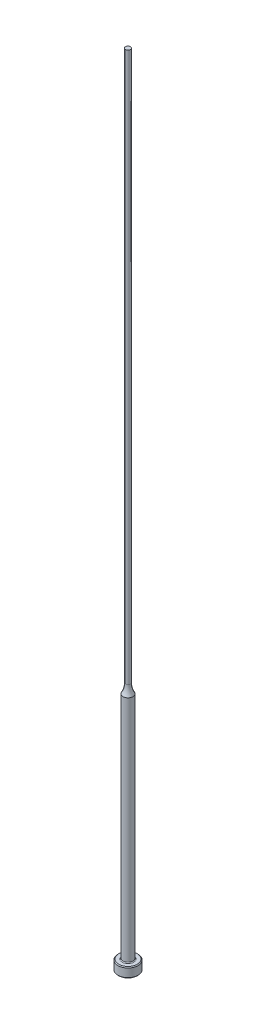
SolidWorks part; units mm, degrees
ref_plane "Front Plane" through (0, 0, 0) normal (0, 0, 1) x (1, 0, 0)
ref_plane "Top Plane" through (0, 0, 0) normal (0, 1, 0) x (1, 0, 0)
ref_plane "Right Plane" through (0, 0, 0) normal (1, 0, 0) x (0, 0, -1)
sketch "Sketch1" plane through (0, 0, 0) normal (0, 0, 1) x (1, 0, 0)
  line L0 (0, 259.9588) -> (0, -15.1925) construction
  line L1 (0, 0) -> (-3.175, 0)
  line L2 (-3.175, 0) -> (-3.175, 3.175)
  line L3 (-3.175, 3.175) -> (-1.5875, 3.175)
  line L4 (-0.7937, 79.2742) -> (-0.7937, 254)
  line L5 (-0.7937, 254) -> (0, 254)
  line L6 (0, 254) -> (0, 0)
  line L7 (-1.5875, 3.175) -> (-1.5875, 76.2)
  arc A0 (-1.5875, 76.2) -> (-0.7937, 79.2742) centre (-7.1437, 79.2742) ccw
  point P13 (-1.5875, 0)
  dimension "D1" = 6.35
  dimension "L" = 254
  dimension "D2" = 3.175
  dimension "H" = 6.35
  dimension "T" = 3.175
  dimension "D" = 1.5875
  dimension "S" = 76.2
revolve "Revolve1" add sketch "Sketch1" angle 360 about L0
chamfer "Chamfer1" distance 0.254 angle 45 2 edges at (0, 3.175, 3.175) (0, 0, 3.175)
fillet "Fillet1" radius 0.254 1 edges at (0, 3.175, 1.5875)
